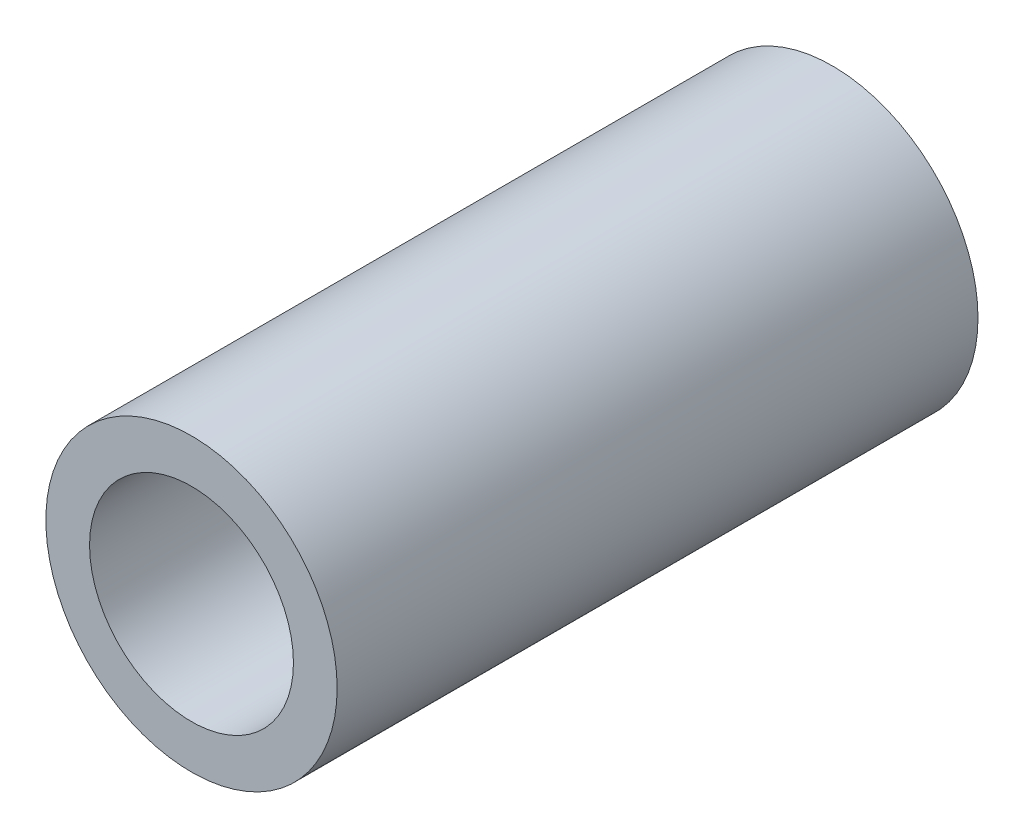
SolidWorks part; units mm, degrees
ref_plane "Piano frontale" through (0, 0, 0) normal (0, 0, 1) x (1, 0, 0)
ref_plane "Piano superiore" through (0, 0, 0) normal (0, 1, 0) x (1, 0, 0)
ref_plane "Piano destro" through (0, 0, 0) normal (1, 0, 0) x (0, 0, -1)
sketch "Sketch1" plane through (0, 0, 0) normal (0, 0, 1) x (1, 0, 0)
  circle A0 centre (0, 0) radius 2.5
  dimension "D1" = 5
extrude "Boss-Extrude1" add sketch "Sketch1" along normal blind 11
sketch "Sketch2" plane through (0, 0, 11) normal (0, 0, 1) x (1, 0, 0)
  circle A0 centre (0, 0) radius 1.75
  dimension "D1" = 3.5
extrude "Cut-Extrude1" cut sketch "Sketch2" against normal blind 4
